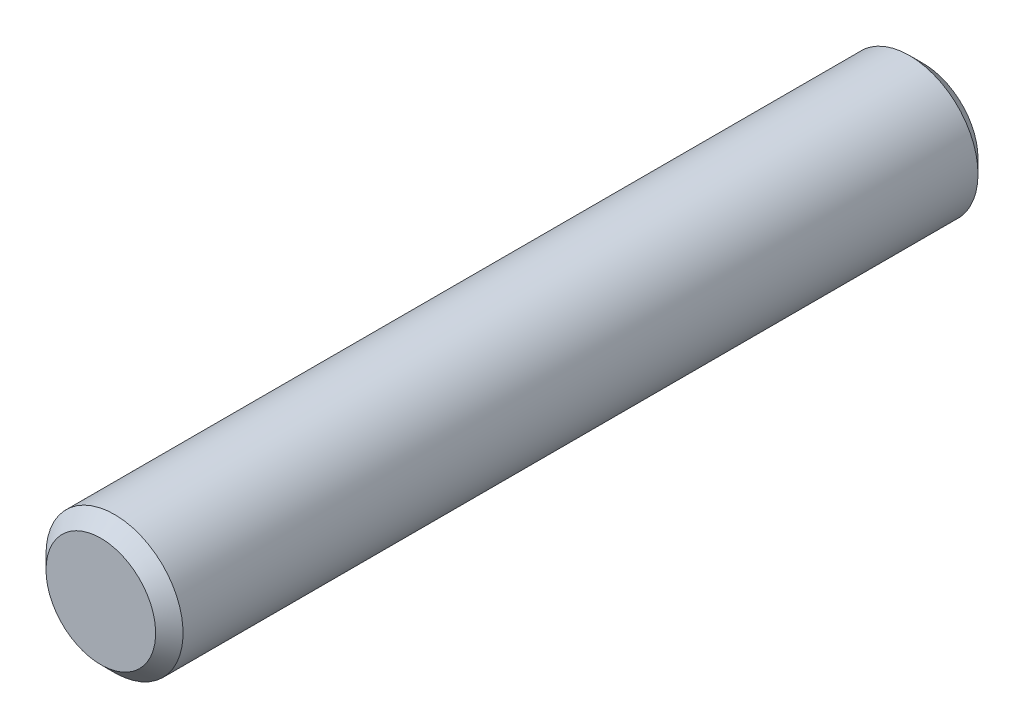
SolidWorks part; units mm, degrees
ref_plane "Front" through (0, 0, 0) normal (0, 0, 1) x (1, 0, 0)
ref_plane "Top" through (0, 0, 0) normal (0, 1, 0) x (1, 0, 0)
ref_plane "Right" through (0, 0, 0) normal (1, 0, 0) x (0, 0, -1)
sketch "Sketch1" plane through (0, 0, 0) normal (0, 0, 1) x (1, 0, 0)
  circle A0 centre (0, 0) radius 3.175
extrude "Extrude1" add sketch "Sketch1" along normal mid plane 38.1
sketch "Sketch2" plane through (0, 0, 0) normal (1, 0, 0) x (0, 0, -1)
  point P0 (-19.05, 3.175)
  point P1 (19.05, 3.175)
chamfer "Chamfer1" distance 0.635 angle 45 2 edges at (3.175, 0, -19.05) (3.175, 0, 19.05)
equation "\"D1@Chamfer1\" = \"dia@Sketch1\" * .1"
